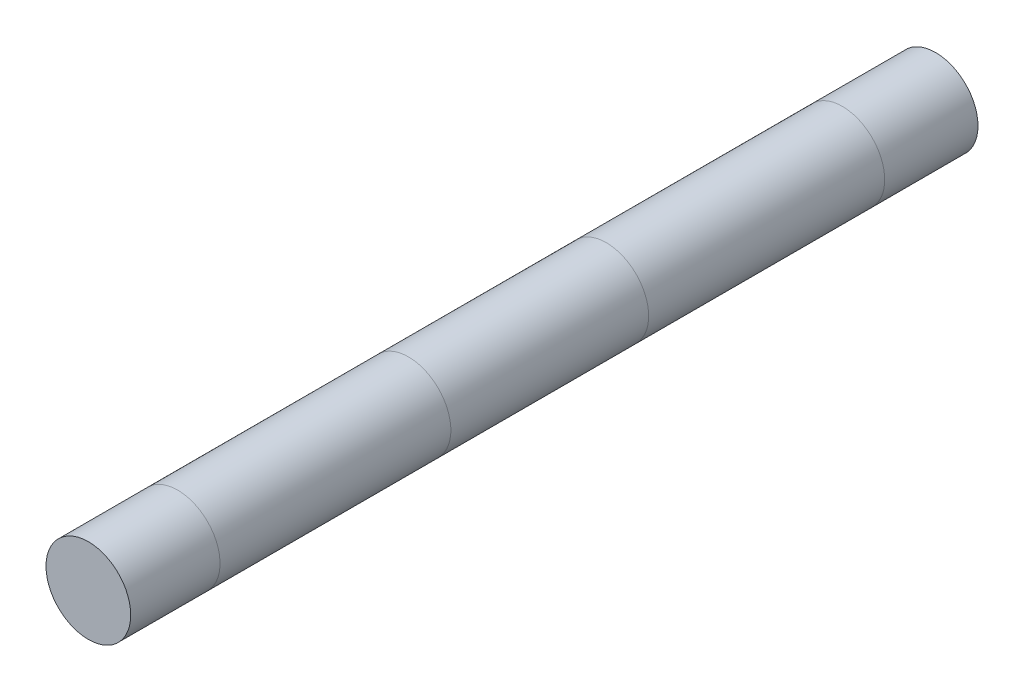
SolidWorks part; units mm, degrees
ref_plane "Front Plane" through (0, 0, 0) normal (0, 0, 1) x (1, 0, 0)
ref_plane "Top Plane" through (0, 0, 0) normal (0, 1, 0) x (1, 0, 0)
ref_plane "Right Plane" through (0, 0, 0) normal (1, 0, 0) x (0, 0, -1)
sketch "Sketch1" plane through (0, 0, 0) normal (0, 0, 1) x (1, 0, 0)
  circle A0 centre (0, 0) radius 12.7
  dimension "D1" = 25.4
extrude "Boss-Extrude1" add sketch "Sketch1" along normal blind 254
sketch "Sketch2" plane through (0, 0, 254) normal (0, 0, 1) x (1, 0, 0)
  circle A0 centre (0, 0) radius 12.7 construction
  circle A1 centre (0, 0) radius 12.7
surface "Surface-Extrude1" sketch "Sketch2" parameters "D1"=25.4
sketch "Sketch3" plane through (0, 0, 0) normal (1, 0, 0) x (0, 0, -1)
  line L0 (-158.0356, 33.4077) -> (-158.0356, -52.3849)
  line L1 (-98.7319, 33.4077) -> (-98.7319, -45.6638)
  line L2 (-27.9628, 29.0588) -> (-27.9628, -33.8031)
  line L3 (-227.2232, 33.4077) -> (-227.2232, -33.8031)
